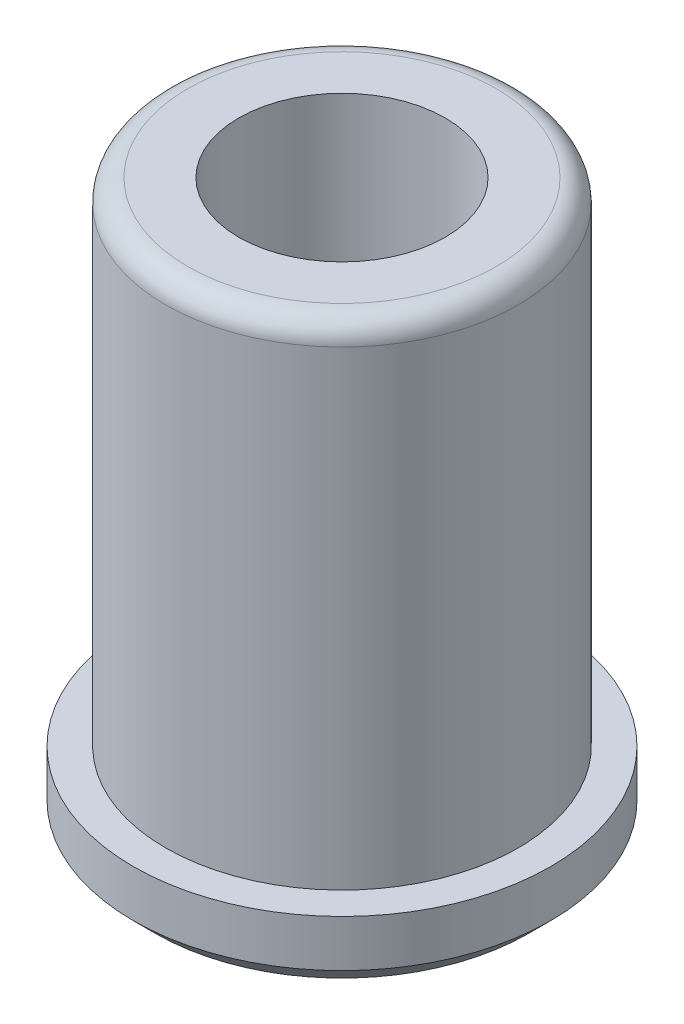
SolidWorks part; units mm, degrees
ref_plane "Front Plane" through (0, 0, 0) normal (0, 0, 1) x (1, 0, 0)
ref_plane "Top Plane" through (0, 0, 0) normal (0, 1, 0) x (1, 0, 0)
ref_plane "Right Plane" through (0, 0, 0) normal (1, 0, 0) x (0, 0, -1)
sketch "Sketch1" plane through (0, 0, 0) normal (0, 1, 0) x (1, 0, 0)
  circle A0 centre (0, 0) radius 2.335
  circle A1 centre (0, 0) radius 3.985
  dimension "D1" = 4.67
  dimension "D2" = 7.97
extrude "Boss-Extrude1" add sketch "Sketch1" along normal mid plane 12.69
fillet "Fillet1" radius 0.5 1 edges at (0, 6.345, 3.985)
sketch "Sketch2" plane through (0, -6.345, 0) normal (0, -1, 0) x (1, 0, 0)
  circle A0 centre (0, 0) radius 4.715
  circle A1 centre (0, 0) radius 3.985
  circle A2 centre (0, 0) radius 3.985
  dimension "D2" = 9.43
  dimension "D1" = 0
extrude "Boss-Extrude2" add sketch "Sketch2" against normal blind 1.56
chamfer "Chamfer1" distance 0.5 angle 45 1 edges at (0, -6.345, -4.715)
chamfer "Chamfer2" distance 0.5 angle 45 1 edges at (0, -6.345, 2.335)
